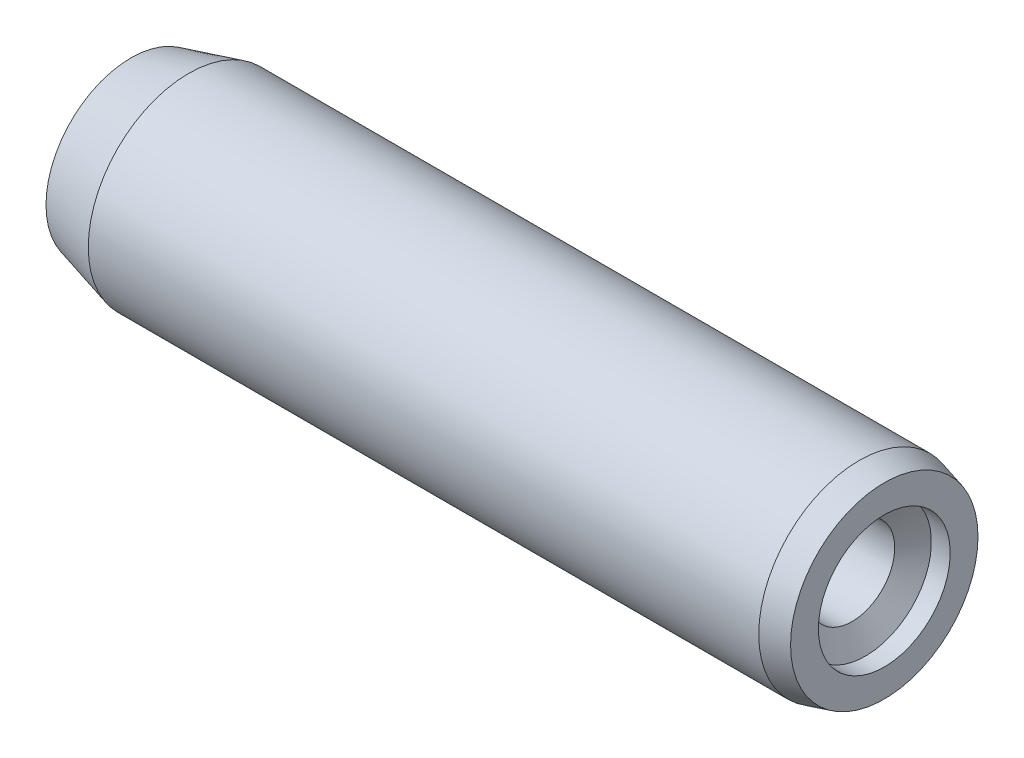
SolidWorks part; units mm, degrees
ref_plane "Plane1" through (0, 0, 0) normal (0, 0, 1) x (1, 0, 0)
ref_plane "Plane2" through (0, 0, 0) normal (0, 1, 0) x (1, 0, 0)
ref_plane "Plane3" through (0, 0, 0) normal (1, 0, 0) x (0, 0, -1)
sketch "BodySke" plane through (0, 0, 0) normal (0, 0, 1) x (1, 0, 0)
  line L0 (0, 0) -> (66, 0) construction
  line L1 (0, 0) -> (40, 0) construction
  line L2 (4.6, 8) -> (58, 8)
  line L3 (58, 8) -> (60, 7.4641)
  line L4 (0, 0) -> (33.5917, 0)
  line L5 (60, 7.4641) -> (60, 5.25)
  line L6 (60, 5.25) -> (58.5, 5.25)
  line L7 (58.5, 5.25) -> (57.4319, 3.4)
  line L8 (57.4319, 3.4) -> (35, 3.4)
  line L9 (35, 3.4) -> (33.5917, 0)
  line L10 (57.25, 7) -> (57.25, 3) construction
  line L11 (44, 16) -> (44, 0) construction
  line L12 (4.6, 8) -> (0, 6.7674)
  line L13 (0, 0) -> (0, 6.7674)
  dimension "D3" = 67.5
  dimension "D2" = 165
  dimension "D1" = 75
  dimension "Diameter" = 16
  dimension "Length" = 60
  dimension "Head_ch_len" = 2
  dimension "Cbore_dia" = 10.5
  dimension "Cbore_dep" = 1.5
  dimension "Tapdrill_dia" = 6.8
  dimension "Tapdrill_dep" = 25
  dimension "D4" = 30
  dimension "Advance" = 1.25
  dimension "Thread_dep" = 16
  dimension "Tip_ch_len" = 4.6
revolve "Body" add sketch "BodySke" angle 360 about L0
sketch "ThdSchSke" plane through (0, 0, 0) normal (0, 0, 1) x (1, 0, 0)
  line L0 (57.7783, 4) -> (58.2618, 3.3095)
  line L2 (57.7783, 4) -> (57.2948, 3.3095)
  line L3 (57.2948, 3.3095) -> (58.2618, 3.3095)
  line L4 (57.7783, 5.8566) -> (57.7783, 1.7596) construction
  line L5 (27, 0) -> (36, 0) construction
  line L6 (0, 0) -> (66, 0) construction
  line L7 (60, -7.4641) -> (60, 7.4641) construction
  dimension "D1" = 70
  dimension "Thread_nominal" = 8
  dimension "Inset" = 2.2217
  dimension "Thread_minor" = 6.619
revolve "ThreadSchematic" [suppressed] cut sketch "ThdSchSke" angle 360 about L5
pattern_linear "ThdSchPat" [suppressed]
equation "' \"Diameter@BodySke\" = 16"
equation "' \"Head_ch_len@BodySke\" = 2"
equation "' \"Tip_ch_len@BodySke\" = 4.6"
equation "' \"Thread_major@ThreadCosmetic\"  = 8"
equation "' \"Advance@BodySke\" = 1.25"
equation "' \"Cbore_dia@BodySke\" = 10.5"
equation "' \"Thread_dep@BodySke\"  = 16"
equation "' \"Tapdrill_dep@BodySke\" = 25"
equation "' \"Cbore_dep@BodySke\" = 1.5"
equation "' \"Tapdrill_dia@BodySke\" = 6.8"
equation "' \"Thread_minor@ThdSchSke\" = 6.619"
equation "'  \"Length@BodySke\" = 60"
equation "' \"Diameter@BodySke\" = 30"
equation "' \"Head_ch_len@BodySke\" = 4"
equation "' \"Tip_ch_len@BodySke\" = 7"
equation "' \"Thread_major@ThreadCosmetic\"  = 20"
equation "' \"Advance@BodySke\" = 2.5"
equation "' \"Cbore_dia@BodySke\" = 21"
equation "' \"Thread_dep@BodySke\"  = 30"
equation "' \"Tapdrill_dep@BodySke\" = 40"
equation "' \"Cbore_dep@BodySke\" = 2"
equation "' \"Tapdrill_dia@BodySke\" = 17.5"
equation "' \"Thread_minor@ThdSchSke\" = 17.252"
equation "\"Depth@ThreadCosmetic\" = \"Thread_dep@BodySke\"  -  \"Cbore_dep@BodySke\""
equation "\"Thread_nominal@ThdSchSke\" = \"Thread_major@ThreadCosmetic\""
equation "\"Inset@ThdSchSke\" = \"Cbore_dep@BodySke\" + (\"Cbore_dia@BodySke\" - \"Thread_major@ThreadCosmetic\") / 2 * tan(30 * 0.0174533)"
equation "\"Num_threads@ThdSchPat\" = int(  ( \"Thread_dep@BodySke\"  - \"Inset@ThdSchSke\" ) / \"Advance@BodySke\" + 0.999 )  + 1"
equation "\"Advance@ThdSchPat\" = (  \"Thread_dep@BodySke\" - \"Inset@ThdSchSke\" ) /  (\"Num_threads@ThdSchPat\" - 1) 'relax it"
